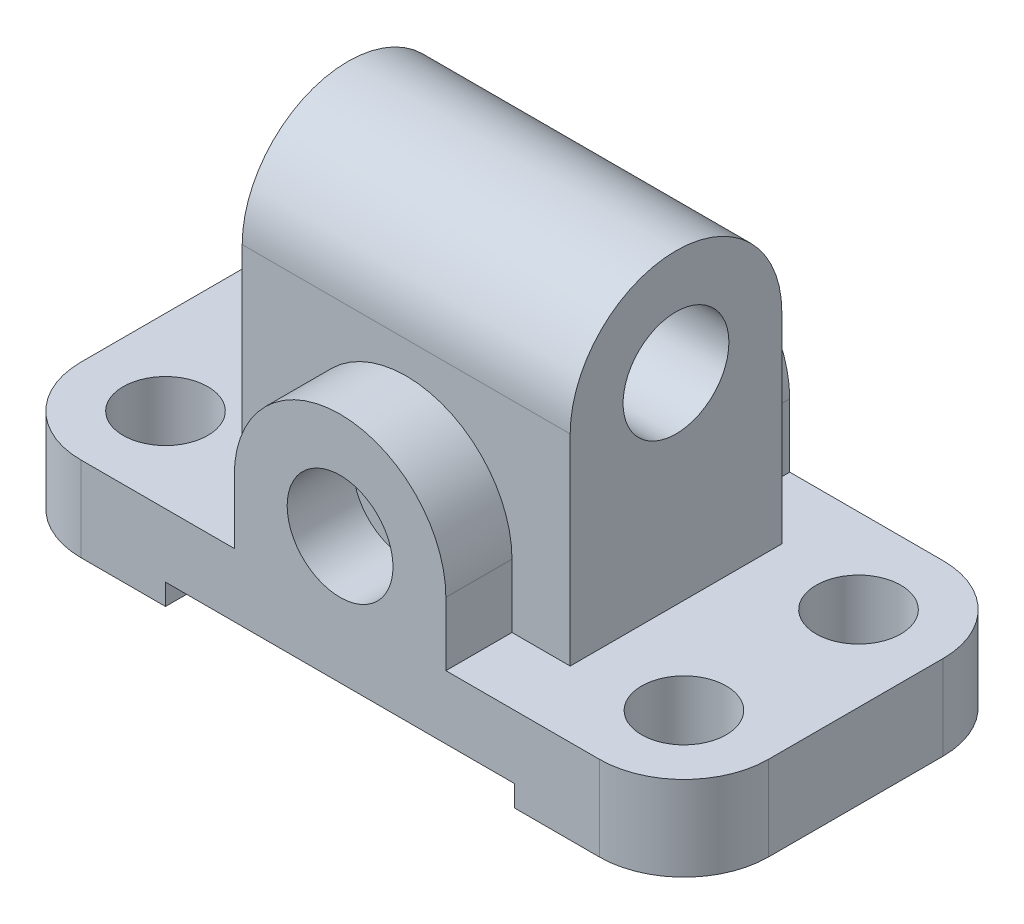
SolidWorks part; units mm, degrees
ref_plane "前视基准面" through (0, 0, 0) normal (0, 0, 1) x (1, 0, 0)
ref_plane "上视基准面" through (0, 0, 0) normal (0, 1, 0) x (1, 0, 0)
ref_plane "右视基准面" through (0, 0, 0) normal (1, 0, 0) x (0, 0, -1)
sketch "草图1" plane through (0, 0, 0) normal (0, 1, 0) x (1, 0, 0)
  line L0 (0, 33.1783) -> (0, -24.3088) construction
  line L1 (98, -65) -> (-98, -65)
  line L2 (130, -33) -> (130, 33)
  line L3 (98, 65) -> (-98, 65)
  line L4 (-130, -33) -> (-130, 33)
  line L5 (-37.4487, 0) -> (47.9606, 0) construction
  arc A0 (-98, 65) -> (-130, 33) centre (-98, 33) ccw
  arc A1 (130, 33) -> (98, 65) centre (98, 33) ccw
  arc A2 (98, -65) -> (130, -33) centre (98, -33) ccw
  arc A3 (-98, -65) -> (-130, -33) centre (-98, -33) cw
  dimension "D3" = 32
  dimension "D1" = 130
  dimension "D2" = 260
extrude "拉伸1" add sketch "草图1" along normal blind 32
sketch "草图3" plane through (0, 0, 0) normal (1, 0, 0) x (0, 0, -1)
  line L0 (40, 32) -> (-40, 32)
  line L1 (65, 32) -> (33, 32) construction
  line L2 (-33, 32) -> (-65, 32) construction
  line L3 (-40, 32) -> (-40, 108)
  line L4 (40, 108) -> (40, 32)
  arc A0 (-40, 108) -> (40, 108) centre (0, 108) cw
  circle A1 centre (0, 108) radius 20
  dimension "D1" = 80
  dimension "D2" = 76
extrude "拉伸3" add sketch "草图3" along normal blind 62 and the other way blind 62
sketch "草图4" plane through (0, 0, -40) normal (0, 0, -1) x (-1, 0, 0)
  line L0 (-40, 32) -> (-40, 56)
  line L1 (62, 32) -> (-62, 32) construction
  line L2 (40, 56) -> (40, 32)
  line L3 (40, 32) -> (-40, 32)
  arc A0 (-40, 56) -> (40, 56) centre (0, 56) cw
  circle A1 centre (0, 56) radius 20
  dimension "D1" = 24
  dimension "D2" = 80
extrude "拉伸4" add sketch "草图4" along normal up to surface (105 mm away)
sketch "草图5" plane through (0, 32, 0) normal (0, 1, 0) x (1, 0, 0)
  line L0 (-40, 65) -> (-98, 65) construction
  line L1 (-130, 33) -> (-130, -33) construction
  circle A0 centre (-98, 33) radius 16
  dimension "D1" = 32
  dimension "D2" = 32
extrude "切除-拉伸1" cut sketch "草图5" against normal through all
mirror "镜向1" about plane through (0, 0, 0) normal (0, 0, 1) of "切除-拉伸1"
mirror "镜向2" about plane through (0, 0, 0) normal (1, 0, 0) of "镜向1", "切除-拉伸1"
sketch "草图6" plane through (0, 0, 40) normal (0, 0, 1) x (1, 0, 0)
  line L0 (-40, 32) -> (-40, 56)
  line L1 (-62, 32) -> (62, 32) construction
  line L2 (40, 56) -> (40, 32)
  line L3 (-98, 32) -> (98, 32) construction
  line L4 (40, 32) -> (-40, 32)
  arc A0 (-40, 56) -> (40, 56) centre (0, 56) cw
  circle A1 centre (0, 56) radius 20
  dimension "D1" = 24
  dimension "D2" = 80
extrude "拉伸5" add sketch "草图6" along normal up to surface (25 mm away)
sketch "草图7" plane through (0, 0, 65) normal (0, 0, 1) x (1, 0, 0)
  line L0 (0, 0) -> (0, -68.8924) construction
  line L1 (-66, 8) -> (66, 8)
  line L2 (-66, 8) -> (-66, -17.2156)
  line L3 (-66, -17.2156) -> (66, -17.2156)
  line L4 (66, 8) -> (66, -17.2156)
  line L5 (-98, 0) -> (98, 0) construction
  dimension "D1" = 132
  dimension "D2" = 8
extrude "切除-拉伸2" cut sketch "草图7" against normal through all
